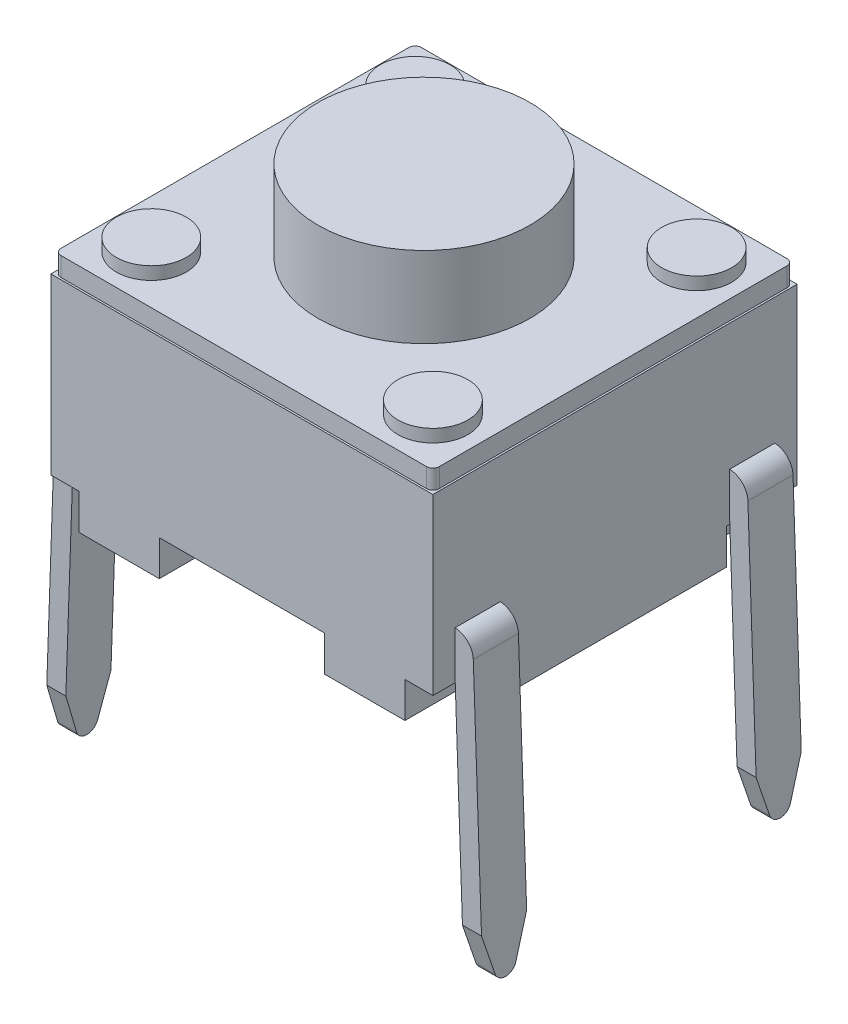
SolidWorks part; units mm, degrees
ref_plane "Plan de face" through (0, 0, 0) normal (0, 0, 1) x (1, 0, 0)
ref_plane "Plan de dessus" through (0, 0, 0) normal (0, 1, 0) x (1, 0, 0)
ref_plane "Plan de droite" through (0, 0, 0) normal (1, 0, 0) x (0, 0, -1)
sketch "Esquisse1" plane through (0, 0, 0) normal (0, 1, 0) x (1, 0, 0)
  line L1 (0, 0) -> (6.01, 0)
  line L2 (0, 0) -> (0, 5.03)
  line L3 (0, 5.03) -> (6.01, 5.03)
  line L4 (6.01, 0) -> (6.01, 5.03)
  dimension "D1" = 6.01
  dimension "D2" = 5.03
extrude "Extrusion1" add sketch "Esquisse1" along normal blind 0.71
sketch "Esquisse3" plane through (0, 0, 0) normal (0, 0, 1) x (1, 0, 0)
  line L0 (5.9852, 0.71) -> (6.1497, -4)
  line L1 (0, 0) -> (6.01, 0) construction
  line L2 (0, 0.71) -> (6.01, 0.71) construction
  line L3 (4.7997, -4) -> (6.9372, -4) construction
  line L4 (6.2854, 0.71) -> (6.4499, -4)
  line L5 (5.9852, 0.71) -> (6.2854, 0.71)
  line L6 (6.285, 0.7205) -> (6.4495, -3.9895) construction
  line L7 (6.1497, -4) -> (6.4499, -4)
  line L8 (3.005, 0.71) -> (3.005, -1.8211) construction
  line L9 (-0.1397, -4) -> (-0.4399, -4)
  line L10 (0.0248, 0.71) -> (-0.2754, 0.71)
  line L11 (-0.2754, 0.71) -> (-0.4399, -4)
  line L12 (0.0248, 0.71) -> (-0.1397, -4)
  dimension "D1" = 92
  dimension "D2" = 4
  dimension "D3" = 0.3
extrude "Extrusion2" add sketch "Esquisse3" against normal blind 0.71
ref_plane "Plan2" through (0, 0, -2.515) normal (0, 0, 1) x (1, 0, 0)
mirror "Symétrie1" about plane through (0, 0, -2.515) normal (0, 0, 1) of "Extrusion2"
fillet "Congé1" radius 0.3 10 edges at (6.01, 0.71, -2.515) (6.1477, 0.71, -0.71) (6.2854, 0.71, -0.355) (-0.1377, 0.71, -0.71) (-0.2754, 0.71, -0.355) (6.2854, 0.71, -4.675) (6.1477, 0.71, -4.32) (0, 0.71, -2.515) (-0.1377, 0.71, -4.32) (-0.2754, 0.71, -4.675)
sketch "Esquisse5" plane through (0, 0, 0) normal (1, 0, 0) x (0, 0, -1)
  line L0 (6.6986, -3.27) -> (-1.3946, -3.27) construction
  line L1 (4.32, 0) -> (0.71, 0) construction
  line L2 (2.515, 0) -> (2.515, -4.3671) construction
  line L3 (0.7147, -3.27) -> (0.5164, -3.8917)
  line L4 (0.355, -4) -> (0.355, -2.9349) construction
  line L5 (0.71, -4) -> (0, -4) construction
  line L6 (-0.0047, -3.27) -> (0.1936, -3.8917)
  line L7 (-0.0047, -3.27) -> (-0.4206, -3.27)
  line L8 (-0.4206, -3.27) -> (-0.4206, -4.4271)
  line L9 (-0.4206, -4.4271) -> (0.9923, -4.4271)
  line L10 (0.9923, -4.4271) -> (0.9923, -3.27)
  line L11 (0.9923, -3.27) -> (0.7147, -3.27)
  line L12 (4.0377, -3.27) -> (4.3153, -3.27)
  line L13 (4.0377, -4.4271) -> (4.0377, -3.27)
  line L14 (5.4506, -4.4271) -> (4.0377, -4.4271)
  line L15 (5.4506, -3.27) -> (5.4506, -4.4271)
  line L16 (5.0347, -3.27) -> (5.4506, -3.27)
  line L17 (5.0347, -3.27) -> (4.8364, -3.8917)
  line L18 (4.3153, -3.27) -> (4.5136, -3.8917)
  arc A0 (0.5164, -3.8917) -> (0.1936, -3.8917) centre (0.355, -3.8256) cw
  arc A1 (4.5136, -3.8917) -> (4.8364, -3.8917) centre (4.675, -3.8256) ccw
  dimension "D1" = 3.27
extrude "Enlèv. mat.-Extru.1" cut sketch "Esquisse5" against normal through all and the other way through all
sketch "Esquisse6" plane through (0, 0, 0) normal (0, -1, 0) x (1, 0, 0)
  line L16 (0, -4.32) -> (0, -5.03)
  line L17 (0, -5.03) -> (6.01, -5.03)
  line L18 (6.01, -5.03) -> (6.01, -4.32)
  line L19 (6.01, -4.32) -> (6.01, -0.71)
  line L20 (6.01, -0.71) -> (6.01, 0)
  line L21 (6.01, 0) -> (0, 0)
  line L22 (0, 0) -> (0, -0.71)
  line L23 (0, -0.71) -> (0, -4.32)
  line L24 (0, -4.32) -> (0, -5.03)
  line L25 (0, -5.03) -> (6.01, -5.03)
  line L26 (6.01, -5.03) -> (6.01, -4.32)
  line L27 (6.01, -4.32) -> (6.01, -0.71)
  line L28 (6.01, -0.71) -> (6.01, 0)
  line L29 (6.01, 0) -> (0, 0)
  line L30 (0, 0) -> (0, -0.71)
  line L31 (0, -0.71) -> (0, -4.32)
  dimension "D1" = 0
extrude "Extrusion3" add sketch "Esquisse6" along normal blind 0.6
ref_plane "Plan4" through (0, 0, -2.515) normal (0, 0, 1) x (1, 0, 0)
sketch "Esquisse7" plane through (0, 0, -2.515) normal (0, 0, -1) x (-1, 0, 0)
  line L1 (-6.01, -0.6) -> (0, -0.6)
  line L2 (-6.01, -0.6) -> (-6.01, 0.71)
  line L3 (-6.01, 0.71) -> (0, 0.71)
  line L4 (0, -0.6) -> (0, 0.71)
extrude "Extrusion4" add sketch "Esquisse7" along normal blind 2.865 and the other way blind 2.865
sketch "Esquisse9" plane through (0, -0.6, 0) normal (0, 1, 0) x (-1, 0, 0)
  line L21 (0, 0.35) -> (-6.01, 0.35)
  line L22 (-6.01, 0.35) -> (-6.01, -5.38)
  line L23 (-6.01, -5.38) -> (0, -5.38)
  line L24 (0, -5.38) -> (0, 0.35)
  line L31 (0, 0.35) -> (-6.01, 0.35)
  line L32 (-6.01, 0.35) -> (-6.01, -5.38)
  line L33 (-6.01, -5.38) -> (0, -5.38)
  line L34 (0, -5.38) -> (0, 0.35)
  dimension "D1" = 0
extrude "Extrusion6" add sketch "Esquisse9" along normal blind 3.3
sketch "Esquisse10" plane through (0, 0, -5.38) normal (0, 0, -1) x (-1, 0, 0)
  line L0 (-6.01, -0.6) -> (0, -0.6) construction
  line L1 (-4.305, -0.6) -> (-1.705, -0.6)
  line L2 (-4.305, -0.6) -> (-4.305, -0.04)
  line L3 (-4.305, -0.04) -> (-1.705, -0.04)
  line L4 (-1.705, -0.6) -> (-1.705, -0.04)
  line L5 (-3.005, -0.04) -> (-3.005, -1.5273) construction
  line L6 (-3.005, 2.7) -> (-3.005, 1.6811) construction
  line L7 (-6.01, 2.7) -> (0, 2.7) construction
  dimension "D1" = 2.6
  dimension "D2" = 0.56
extrude "Enlèv. mat.-Extru.2" cut sketch "Esquisse10" against normal through all
sketch "Esquisse11" plane through (0, -0.6, 0) normal (0, -1, 0) x (1, 0, 0)
  line L0 (1.705, 0.35) -> (1.705, -5.38) construction
  line L1 (1.705, -1.955) -> (0.565, -1.955)
  line L2 (1.705, -1.955) -> (1.705, -3.075)
  line L3 (1.705, -3.075) -> (0.565, -3.075)
  line L4 (0.565, -1.955) -> (0.565, -3.075)
  line L5 (4.305, -2.515) -> (3.353, -2.515) construction
  line L6 (4.305, 0.35) -> (4.305, -5.38) construction
  line L7 (0.565, -2.515) -> (0.8951, -2.515) construction
  line L8 (3.005, -5.38) -> (3.005, 0) construction
  line L9 (1.705, -5.38) -> (4.305, -5.38) construction
  line L10 (5.445, -1.955) -> (5.445, -3.075)
  line L11 (4.305, -3.075) -> (5.445, -3.075)
  line L12 (4.305, -1.955) -> (4.305, -3.075)
  line L13 (4.305, -1.955) -> (5.445, -1.955)
  dimension "D1" = 1.12
  dimension "D2" = 1.14
extrude "Enlèv. mat.-Extru.3" cut sketch "Esquisse11" against normal up to surface (0.56 mm away)
sketch "Esquisse12" plane through (0, -0.6, 0) normal (0, -1, 0) x (1, 0, 0)
  line L0 (3.005, -5.38) -> (3.005, -3.276) construction
  line L1 (6.01, -5.38) -> (5.57, -5.38)
  line L2 (6.01, -5.38) -> (6.01, -4.27)
  line L3 (6.01, -4.27) -> (5.57, -4.27)
  line L4 (5.57, -5.38) -> (5.57, -4.27)
  line L5 (1.705, -5.38) -> (4.305, -5.38) construction
  line L6 (0.44, -5.38) -> (0.44, -4.27)
  line L7 (0, -4.27) -> (0.44, -4.27)
  line L8 (0, -5.38) -> (0, -4.27)
  line L9 (0, -5.38) -> (0.44, -5.38)
  line L10 (6.01, -2.515) -> (3.5545, -2.515) construction
  line L11 (6.01, -5.38) -> (6.01, 0.35) construction
  line L12 (0, 0.35) -> (0.44, 0.35)
  line L13 (0, 0.35) -> (0, -0.76)
  line L14 (0, -0.76) -> (0.44, -0.76)
  line L15 (0.44, 0.35) -> (0.44, -0.76)
  line L16 (5.57, 0.35) -> (5.57, -0.76)
  line L17 (6.01, -0.76) -> (5.57, -0.76)
  line L18 (6.01, 0.35) -> (6.01, -0.76)
  line L19 (6.01, 0.35) -> (5.57, 0.35)
  dimension "D1" = 1.11
  dimension "D2" = 0.44
extrude "Enlèv. mat.-Extru.4" cut sketch "Esquisse12" against normal up to surface (0.56 mm away)
sketch "Esquisse13" plane through (0, 2.7, 0) normal (0, 1, 0) x (-1, 0, 0)
  line L12 (-0.03, -5.35) -> (-0.03, 0.32)
  line L13 (-0.03, 0.32) -> (-5.98, 0.32)
  line L14 (-5.98, 0.32) -> (-5.98, -5.35)
  line L15 (-5.98, -5.35) -> (-0.03, -5.35)
  line L16 (-0.03, -5.35) -> (-0.03, 0.32)
  line L17 (-0.03, 0.32) -> (-5.98, 0.32)
  line L18 (-5.98, 0.32) -> (-5.98, -5.35)
  line L19 (-5.98, -5.35) -> (-0.03, -5.35)
  dimension "D1" = 0.03
extrude "Extrusion7" add sketch "Esquisse13" along normal blind 0.3
sketch "Esquisse14" plane through (0, 3, 0) normal (0, 1, 0) x (-1, 0, 0)
  line L0 (-5.98, -2.515) -> (-0.03, -2.515) construction
  line L1 (-5.98, 0.32) -> (-5.98, -5.35) construction
  line L2 (-0.03, -5.35) -> (-0.03, 0.32) construction
  circle A0 centre (-3.005, -2.515) radius 1.67
  dimension "D1" = 3.34
extrude "Extrusion8" add sketch "Esquisse14" along normal blind 1.27
sketch "Esquisse15" plane through (0, 3, 0) normal (0, 1, 0) x (-1, 0, 0)
  line L0 (-0.03, -4.59) -> (-1.003, -4.59) construction
  line L1 (-0.03, -5.35) -> (-0.03, 0.32) construction
  line L2 (-0.79, -5.35) -> (-0.79, -4.228) construction
  line L3 (-5.98, -5.35) -> (-0.03, -5.35) construction
  line L4 (-0.03, -2.515) -> (-2.209, -2.515) construction
  line L5 (-3.005, -5.35) -> (-3.005, -3.4456) construction
  circle A0 centre (-0.79, -4.59) radius 0.55
  circle A1 centre (-0.79, -0.44) radius 0.55
  circle A2 centre (-5.22, -0.44) radius 0.55
  circle A3 centre (-5.22, -4.59) radius 0.55
  dimension "D3" = 1.1
  dimension "D1" = 0.76
  dimension "D2" = 0.76
extrude "Extrusion9" add sketch "Esquisse15" along normal blind 0.2
fillet "Congé2" radius 0.1 4 edges at (5.98, 2.85, -5.35) (0.03, 2.85, -5.35) (0.03, 2.85, 0.32) (5.98, 2.85, 0.32)
